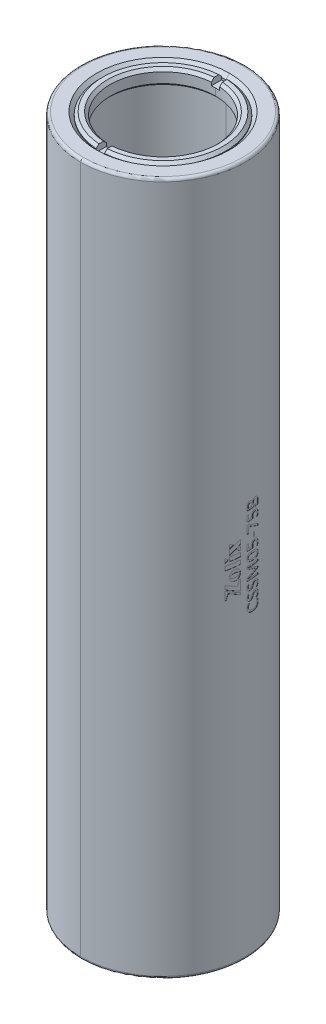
SolidWorks part; units mm, degrees
ref_plane "前视基准面" through (0, 0, 0) normal (0, 0, 1) x (1, 0, 0)
ref_plane "上视基准面" through (0, 0, 0) normal (0, 1, 0) x (1, 0, 0)
ref_plane "右视基准面" through (0, 0, 0) normal (1, 0, 0) x (0, 0, -1)
imported_body "SM05卡环.STEP-1-solid1"
imported_body "SM05卡环.STEP-2-solid1"
imported_body "CSSM05-75B-1.STEP-1-solid1"
sketch "草图1" plane through (0, 0, 0) normal (1, 0, 0) x (0, 0, -1)
  line L0 (8.9, 26.5082) -> (8.9, -47.8918) construction
  point P0 (-0.5, -10.6918)
  point P3 (8.9, -10.6918)
  line B0 (-0.5, -10.4792) -> (-0.5, -10.9043)
  line B1 (-0.5, -10.9043) -> (-1.9984, -10.9043)
  line B2 (-1.9984, -10.9043) -> (-1.9984, -10.4792)
  line B3 (-1.9984, -10.4792) -> (-0.5, -10.4792)
  line B4 (-1.5827, -9.613) -> (-1.5827, -9.1234)
  line B5 (-1.5827, -9.1234) -> (-0.5, -8.5288)
  line B6 (-0.5, -8.5288) -> (-0.5, -9.009)
  line B7 (-0.5, -9.009) -> (-1.5827, -9.613)
  line B8 (-1.5827, -9.0037) -> (-1.5827, -8.5598)
  line B9 (-1.5827, -8.5598) -> (-1.2035, -8.7817)
  line B10 (-1.2035, -8.7817) -> (-1.5827, -9.0037)
  line B11 (-0.9157, -9.3628) -> (-0.5, -9.6155)
  line B12 (-0.5, -9.6155) -> (-0.5, -9.1368)
  line B13 (-0.5, -9.1368) -> (-0.9157, -9.3628)
  line B14 (-1.0488, -11.885) -> (-1.1109, -11.8829)
  line B15 (-1.1109, -11.8829) -> (-1.1696, -11.8764)
  line B16 (-1.1696, -11.8764) -> (-1.2248, -11.8662)
  line B17 (-1.2248, -11.8662) -> (-1.2766, -11.853)
  line B18 (-1.2766, -11.853) -> (-1.3247, -11.8376)
  line B19 (-1.3247, -11.8376) -> (-1.369, -11.8202)
  line B20 (-1.369, -11.8202) -> (-1.4096, -11.8018)
  line B21 (-1.4096, -11.8018) -> (-1.4463, -11.7828)
  line B22 (-1.4463, -11.7828) -> (-1.4789, -11.7636)
  line B23 (-1.4789, -11.7636) -> (-1.5076, -11.7449)
  line B24 (-1.5076, -11.7449) -> (-1.532, -11.7276)
  line B25 (-1.532, -11.7276) -> (-1.5523, -11.7119)
  line B26 (-1.5523, -11.7119) -> (-1.5682, -11.6988)
  line B27 (-1.5682, -11.6988) -> (-1.5799, -11.6886)
  line B28 (-1.5799, -11.6886) -> (-1.5869, -11.6817)
  line B29 (-1.5869, -11.6817) -> (-1.5895, -11.6793)
  line B30 (-1.5895, -11.6793) -> (-1.5895, -11.6807)
  line B31 (-1.5895, -11.6807) -> (-1.5867, -11.7358)
  line B32 (-1.5867, -11.7358) -> (-1.5785, -11.7896)
  line B33 (-1.5785, -11.7896) -> (-1.5652, -11.8414)
  line B34 (-1.5652, -11.8414) -> (-1.547, -11.8912)
  line B35 (-1.547, -11.8912) -> (-1.5242, -11.9384)
  line B36 (-1.5242, -11.9384) -> (-1.4972, -11.983)
  line B37 (-1.4972, -11.983) -> (-1.466, -12.0245)
  line B38 (-1.466, -12.0245) -> (-1.4311, -12.0629)
  line B39 (-1.4311, -12.0629) -> (-1.3927, -12.0977)
  line B40 (-1.3927, -12.0977) -> (-1.3511, -12.1291)
  line B41 (-1.3511, -12.1291) -> (-1.3065, -12.1561)
  line B42 (-1.3065, -12.1561) -> (-1.2593, -12.1789)
  line B43 (-1.2593, -12.1789) -> (-1.2095, -12.1969)
  line B44 (-1.2095, -12.1969) -> (-1.1578, -12.2102)
  line B45 (-1.1578, -12.2102) -> (-1.1041, -12.2185)
  line B46 (-1.1041, -12.2185) -> (-1.0488, -12.2214)
  line B47 (-1.0488, -12.2214) -> (-0.9935, -12.2185)
  line B48 (-0.9935, -12.2185) -> (-0.9399, -12.2102)
  line B49 (-0.9399, -12.2102) -> (-0.888, -12.1969)
  line B50 (-0.888, -12.1969) -> (-0.8383, -12.1789)
  line B51 (-0.8383, -12.1789) -> (-0.7911, -12.1561)
  line B52 (-0.7911, -12.1561) -> (-0.7465, -12.1291)
  line B53 (-0.7465, -12.1291) -> (-0.7048, -12.0977)
  line B54 (-0.7048, -12.0977) -> (-0.6664, -12.0629)
  line B55 (-0.6664, -12.0629) -> (-0.6314, -12.0245)
  line B56 (-0.6314, -12.0245) -> (-0.6004, -11.983)
  line B57 (-0.6004, -11.983) -> (-0.5732, -11.9384)
  line B58 (-0.5732, -11.9384) -> (-0.5505, -11.8912)
  line B59 (-0.5505, -11.8912) -> (-0.5324, -11.8414)
  line B60 (-0.5324, -11.8414) -> (-0.5189, -11.7896)
  line B61 (-0.5189, -11.7896) -> (-0.5109, -11.7358)
  line B62 (-0.5109, -11.7358) -> (-0.5081, -11.6807)
  line B63 (-0.5081, -11.6807) -> (-0.5081, -11.6793)
  line B64 (-0.5081, -11.6793) -> (-0.5105, -11.6816)
  line B65 (-0.5105, -11.6816) -> (-0.5177, -11.6881)
  line B66 (-0.5177, -11.6881) -> (-0.5295, -11.6983)
  line B67 (-0.5295, -11.6983) -> (-0.5453, -11.7115)
  line B68 (-0.5453, -11.7115) -> (-0.5658, -11.727)
  line B69 (-0.5658, -11.727) -> (-0.5904, -11.7444)
  line B70 (-0.5904, -11.7444) -> (-0.619, -11.763)
  line B71 (-0.619, -11.763) -> (-0.6518, -11.7822)
  line B72 (-0.6518, -11.7822) -> (-0.6886, -11.8014)
  line B73 (-0.6886, -11.8014) -> (-0.7291, -11.8201)
  line B74 (-0.7291, -11.8201) -> (-0.7735, -11.8374)
  line B75 (-0.7735, -11.8374) -> (-0.8214, -11.853)
  line B76 (-0.8214, -11.853) -> (-0.8731, -11.866)
  line B77 (-0.8731, -11.866) -> (-0.9283, -11.8762)
  line B78 (-0.9283, -11.8762) -> (-0.9869, -11.8829)
  line B79 (-0.9869, -11.8829) -> (-1.0488, -11.885)
  line B80 (-1.5895, -11.6693) -> (-1.5869, -11.6669)
  line B81 (-1.5869, -11.6669) -> (-1.5799, -11.6602)
  line B82 (-1.5799, -11.6602) -> (-1.5682, -11.65)
  line B83 (-1.5682, -11.65) -> (-1.5523, -11.6368)
  line B84 (-1.5523, -11.6368) -> (-1.532, -11.6211)
  line B85 (-1.532, -11.6211) -> (-1.5076, -11.6037)
  line B86 (-1.5076, -11.6037) -> (-1.4789, -11.5853)
  line B87 (-1.4789, -11.5853) -> (-1.4463, -11.5661)
  line B88 (-1.4463, -11.5661) -> (-1.4096, -11.547)
  line B89 (-1.4096, -11.547) -> (-1.369, -11.5284)
  line B90 (-1.369, -11.5284) -> (-1.3247, -11.5112)
  line B91 (-1.3247, -11.5112) -> (-1.2766, -11.4957)
  line B92 (-1.2766, -11.4957) -> (-1.2248, -11.4826)
  line B93 (-1.2248, -11.4826) -> (-1.1696, -11.4726)
  line B94 (-1.1696, -11.4726) -> (-1.1109, -11.4661)
  line B95 (-1.1109, -11.4661) -> (-1.0488, -11.4636)
  line B96 (-1.0488, -11.4636) -> (-0.9869, -11.4661)
  line B97 (-0.9869, -11.4661) -> (-0.9283, -11.4726)
  line B98 (-0.9283, -11.4726) -> (-0.8731, -11.4826)
  line B99 (-0.8731, -11.4826) -> (-0.8214, -11.4959)
  line B100 (-0.8214, -11.4959) -> (-0.7735, -11.5114)
  line B101 (-0.7735, -11.5114) -> (-0.7291, -11.5288)
  line B102 (-0.7291, -11.5288) -> (-0.6886, -11.5472)
  line B103 (-0.6886, -11.5472) -> (-0.6518, -11.5665)
  line B104 (-0.6518, -11.5665) -> (-0.619, -11.5856)
  line B105 (-0.619, -11.5856) -> (-0.5904, -11.6042)
  line B106 (-0.5904, -11.6042) -> (-0.5658, -11.6216)
  line B107 (-0.5658, -11.6216) -> (-0.5453, -11.6373)
  line B108 (-0.5453, -11.6373) -> (-0.5295, -11.6504)
  line B109 (-0.5295, -11.6504) -> (-0.5177, -11.6605)
  line B110 (-0.5177, -11.6605) -> (-0.5105, -11.6671)
  line B111 (-0.5105, -11.6671) -> (-0.5081, -11.6693)
  line B112 (-0.5081, -11.6693) -> (-0.511, -11.6144)
  line B113 (-0.511, -11.6144) -> (-0.5195, -11.561)
  line B114 (-0.5195, -11.561) -> (-0.5329, -11.5095)
  line B115 (-0.5329, -11.5095) -> (-0.5512, -11.4602)
  line B116 (-0.5512, -11.4602) -> (-0.5739, -11.4132)
  line B117 (-0.5739, -11.4132) -> (-0.6011, -11.3689)
  line B118 (-0.6011, -11.3689) -> (-0.6321, -11.3276)
  line B119 (-0.6321, -11.3276) -> (-0.6669, -11.2895)
  line B120 (-0.6669, -11.2895) -> (-0.7053, -11.255)
  line B121 (-0.7053, -11.255) -> (-0.7467, -11.2242)
  line B122 (-0.7467, -11.2242) -> (-0.7913, -11.1973)
  line B123 (-0.7913, -11.1973) -> (-0.8384, -11.1748)
  line B124 (-0.8384, -11.1748) -> (-0.8881, -11.1569)
  line B125 (-0.8881, -11.1569) -> (-0.9399, -11.1436)
  line B126 (-0.9399, -11.1436) -> (-0.9935, -11.1353)
  line B127 (-0.9935, -11.1353) -> (-1.0488, -11.1327)
  line B128 (-1.0488, -11.1327) -> (-1.1038, -11.1353)
  line B129 (-1.1038, -11.1353) -> (-1.1572, -11.1436)
  line B130 (-1.1572, -11.1436) -> (-1.2089, -11.1569)
  line B131 (-1.2089, -11.1569) -> (-1.2584, -11.1748)
  line B132 (-1.2584, -11.1748) -> (-1.3054, -11.1973)
  line B133 (-1.3054, -11.1973) -> (-1.3498, -11.2242)
  line B134 (-1.3498, -11.2242) -> (-1.3912, -11.255)
  line B135 (-1.3912, -11.255) -> (-1.4296, -11.2895)
  line B136 (-1.4296, -11.2895) -> (-1.4645, -11.3276)
  line B137 (-1.4645, -11.3276) -> (-1.4955, -11.3689)
  line B138 (-1.4955, -11.3689) -> (-1.5227, -11.4132)
  line B139 (-1.5227, -11.4132) -> (-1.5457, -11.4602)
  line B140 (-1.5457, -11.4602) -> (-1.564, -11.5095)
  line B141 (-1.564, -11.5095) -> (-1.5777, -11.561)
  line B142 (-1.5777, -11.561) -> (-1.5862, -11.6144)
  line B143 (-1.5862, -11.6144) -> (-1.5895, -11.6693)
  line B144 (-1.9997, -12.255) -> (-1.9997, -12.676)
  line B145 (-1.9997, -12.676) -> (-0.5, -13.4146)
  line B146 (-0.5, -13.4146) -> (-0.5, -12.2724)
  line B147 (-0.5, -12.2724) -> (-0.6438, -12.2724)
  line B148 (-0.6438, -12.2724) -> (-0.7985, -12.8431)
  line B149 (-0.7985, -12.8431) -> (-1.9997, -12.255)
  line B150 (-1.9997, -12.8079) -> (-0.5, -13.5464)
  line B151 (-0.5, -13.5464) -> (-0.5, -13.7309)
  line B152 (-0.5, -13.7309) -> (-1.7078, -13.1321)
  line B153 (-1.7078, -13.1321) -> (-1.8827, -13.7145)
  line B154 (-1.8827, -13.7145) -> (-1.9997, -13.7145)
  line B155 (-1.9997, -13.7145) -> (-1.9997, -12.8079)
  line B156 (-0.5, -9.7623) -> (-0.5, -10.186)
  line B157 (-0.5, -10.186) -> (-1.5827, -10.186)
  line B158 (-1.5827, -10.186) -> (-1.5827, -9.7623)
  line B159 (-1.5827, -9.7623) -> (-0.5, -9.7623)
  line B160 (-1.9984, -10.1953) -> (-1.6096, -9.983)
  line B161 (-1.6096, -9.983) -> (-1.9984, -9.7609)
  line B162 (-1.9984, -9.7609) -> (-1.9984, -10.1953)
  dimension "D1" = 0.5
sketch_block_instance "1.5mmLogo字体-1"
sketch_block "1.5mmLogo字体" parameters "D1"=0.0031, "D2"=0.8502, "D3"=0.2341
wrap "包覆1" sketch "草图1" wrap type deboss source sketch "草图1" thickness 0.02 parameters "D1"=0.02
sketch "草图2" plane through (0, 0, 0) normal (1, 0, 0) x (0, 0, -1)
  line L0 (1.5003, -16.6918) -> (1.5003, -4.6918) construction
  line L1 (-0.4997, -13.4146) -> (-0.4997, -12.2724) construction
  line L2 (-0.4997, -10.9043) -> (-0.4997, -10.4792) construction
  text T0 "CSSM05-75B" font "Calibri" height 1.3
  point P4 (1.5003, -10.6918)
  point P7 (-0.4997, -10.6918)
  dimension "D1" = 2
  dimension "D2" = 12
wrap "包覆2" sketch "草图2" wrap type deboss source sketch "草图2" thickness 0.02 parameters "D1"=0.02
